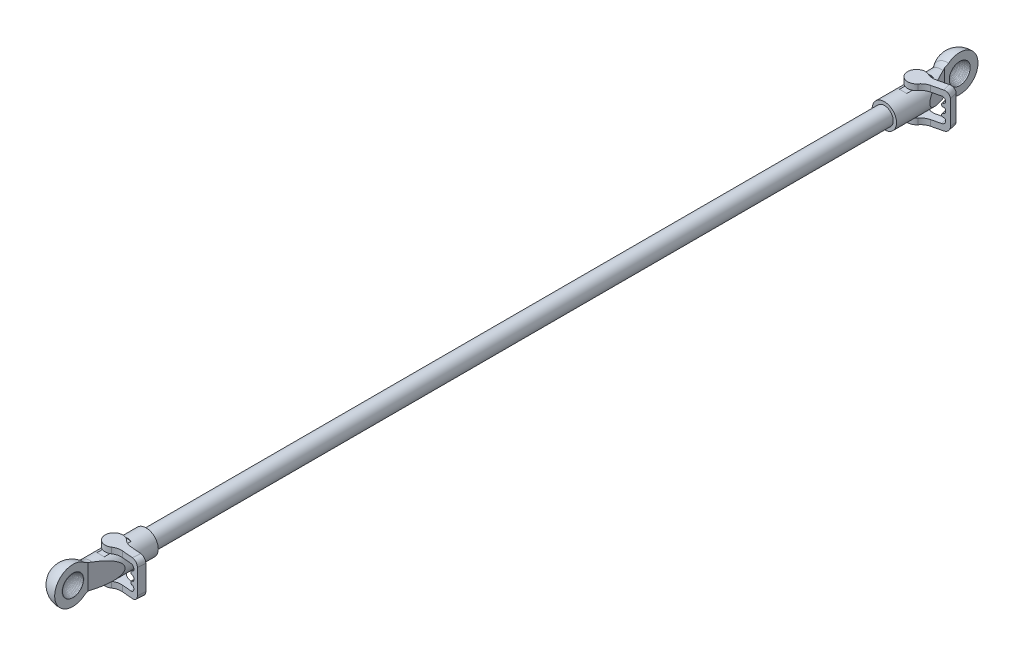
SolidWorks part; units mm, degrees
other "NONE"
ref_plane "前视基准面" through (0, 0, 0) normal (0, 0, 1) x (1, 0, 0)
ref_plane "上视基准面" through (0, 0, 0) normal (0, 1, 0) x (1, 0, 0)
ref_plane "右视基准面" through (0, 0, 0) normal (1, 0, 0) x (0, 0, -1)
imported_body "曲面-输入1"
imported_body "曲面-输入2"
imported_body "曲面-输入3"
imported_body "输入1"
imported_body "输入2"
sketch "草图1" plane through (0, 0, 0) normal (0, 1, 0) x (1, 0, 0)
  line L0 (0, 742.5) -> (0, 743.3254)
  line L1 (0, 743.3254) -> (-10.1534, 743.3254)
  line L2 (-10.1534, 743.3254) -> (-10.1534, 733)
  line L3 (-10.1534, 733) -> (40.996, 733) construction
  line L5 (-9.5, 733) -> (-10.1534, 733)
  arc A0 (0, 742.5) -> (-9.5, 733) centre (0, 733) ccw
revolve "旋转1" add sketch "草图1" angle 360 about L3
sketch "草图2" plane through (0, 0, 0) normal (0, 1, 0) x (1, 0, 0)
  line L0 (1, -67) -> (-9.5, -67) construction
  line L1 (1, -83.4697) -> (1, -56.9361) construction
  line L2 (-10.1271, -57.1479) -> (-10.1271, -67)
  line L3 (-10.1271, -57.1479) -> (1, -57.1479)
  line L4 (1, -57.1479) -> (1, -57.5528)
  line L5 (-10.1271, -67) -> (-9.5, -67)
  arc A0 (1, -57.5528) -> (-9.5, -67) centre (0, -67) ccw
revolve "旋转2" add sketch "草图2" angle 360 about L0
